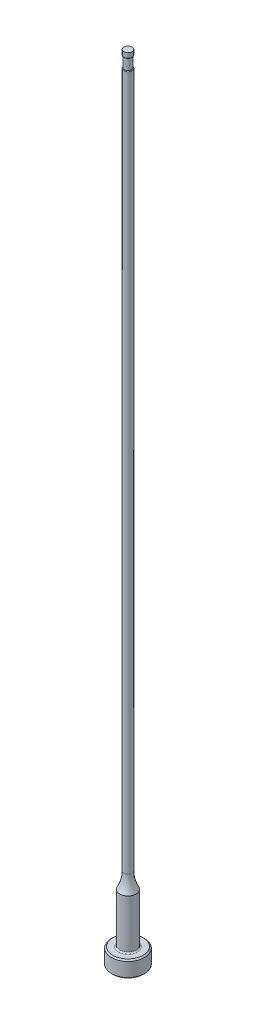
SolidWorks part; units mm, degrees
ref_plane "Front Plane" through (0, 0, 0) normal (0, 0, 1) x (1, 0, 0)
ref_plane "Top Plane" through (0, 0, 0) normal (0, 1, 0) x (1, 0, 0)
ref_plane "Right Plane" through (0, 0, 0) normal (1, 0, 0) x (0, 0, -1)
other "Configuration Table"
sketch "Sketch1" plane through (0, 0, 0) normal (0, 0, 1) x (1, 0, 0)
  line L0 (0, 259.9588) -> (0, -15.1925) construction
  line L1 (0, 0) -> (-3.175, 0)
  line L2 (-3.175, 0) -> (-3.175, 3.175)
  line L3 (-3.175, 3.175) -> (-1.5875, 3.175)
  line L4 (-0.7937, 15.7742) -> (-0.7937, 152.4)
  line L5 (-0.7937, 152.4) -> (0, 152.4)
  line L6 (0, 152.4) -> (0, 0)
  line L7 (-1.5875, 3.175) -> (-1.5875, 12.7)
  arc A1 (-1.5875, 12.7) -> (-0.7937, 15.7742) centre (-7.1437, 15.7742) ccw
  dimension "D1" = 6.35
  dimension "L" = 152.4
  dimension "D2" = 3.175
  dimension "H" = 6.35
  dimension "T" = 3.175
  dimension "D" = 1.5875
  dimension "S" = 12.7
revolve "Revolve1" add sketch "Sketch1" angle 360 about L0
chamfer "Chamfer1" distance 0.254 angle 45 2 edges at (0, 3.175, 3.175) (0, 0, 3.175)
fillet "Fillet1" radius 0.254 1 edges at (0, 3.175, 1.5875)
sketch "Sketch2" plane through (0, 0, 0) normal (0, 0, 1) x (1, 0, 0)
  line L0 (-0.7937, 152.4) -> (-0.7937, 15.7742) construction
  line L1 (-0.7937, 151.384) -> (-0.6921, 151.384)
  line L2 (-0.7937, 151.384) -> (-0.7937, 149.352)
  line L3 (-0.7937, 149.352) -> (-0.6921, 149.352)
  line L4 (-0.6921, 151.384) -> (-0.6921, 149.352)
  line L5 (0.7937, 152.4) -> (-0.7937, 152.4) construction
  line L6 (0, 153.4483) -> (0, 147.3282) construction
  dimension "D1" = 2.032
  dimension "N" = 1.016
  dimension "FD" = 0.1016
  dimension "D3" = 1.3843
revolve "Vent Relief" cut sketch "Sketch2" angle 360 about L6
sketch "Sketch3" plane through (0, 0, 0) normal (0, 0, 1) x (1, 0, 0)
  line L0 (-0.6921, 150.368) -> (-0.6921, 112.268)
  line L1 (-0.6921, 151.384) -> (-0.6921, 149.352) construction
  line L2 (-0.7937, 149.352) -> (-0.7937, 15.7742) construction
  line L3 (-0.7937, 111.4712) -> (-0.7937, 150.368)
  line L4 (-0.7937, 150.368) -> (-0.6921, 150.368)
  arc A0 (-0.6921, 112.268) -> (-0.7937, 111.4712) centre (-3.8671, 112.268) cw
  dimension "D1" = 3.175
  dimension "D2" = 38.1
extrude "D-Slot" cut sketch "Sketch3" against normal through all both and the other way through all
sketch "Sketch5" plane through (0, 0, 0) normal (0, 0, 1) x (1, 0, 0)
  line L0 (-0.7937, 151.384) -> (0.7937, 151.384) construction
  line L1 (-0.7937, 152.4) -> (-0.7887, 152.4)
  line L2 (-0.7937, 152.4) -> (-0.7937, 151.384)
  line L3 (-0.7937, 151.384) -> (-0.7887, 151.384)
  line L4 (-0.7887, 152.4) -> (-0.7887, 151.384)
  line L5 (0, 152.6877) -> (0, 150.5771) construction
  dimension "VP" = 0.0051
revolve "Vent Diameter" cut sketch "Sketch5" angle 360 about L5
fillet "Fillet2" radius 0.127 2 edges at (0.7937, 149.352, 0) (0, 151.384, 0.7887)
sketch "Pocket Sketch" plane through (0, 0, 0) normal (0, 0, 1) x (1, 0, 0)
  line L0 (-3.5719, 0) -> (-3.5719, 3.2004)
  line L1 (-3.5719, 3.2004) -> (-1.7542, 3.2004)
  line L2 (-0.9922, 3.9624) -> (-0.9922, 22.225)
  line L3 (-0.9922, 22.225) -> (0, 22.225)
  line L4 (0, 22.225) -> (0, 0)
  line L5 (0, 0) -> (-3.5719, 0)
  line L6 (0, 12.6104) -> (0, -2.4989) construction
  line L7 (-3.175, 2.921) -> (-3.175, 0.254) construction
  line L8 (2.921, 3.175) -> (-2.921, 3.175) construction
  line L9 (-0.7937, 111.4712) -> (-0.7937, 15.7742) construction
  line L10 (-1.7542, 3.2004) -> (-0.9922, 3.9624)
  point P3 (-0.9922, 3.2004)
  dimension "D1" = 7.1437
  dimension "D2" = 0.3969
  dimension "D3" = 0.0254
  dimension "D4" = 0.1984
  dimension "D5" = 1.9844
  dimension "D6" = 22.225
